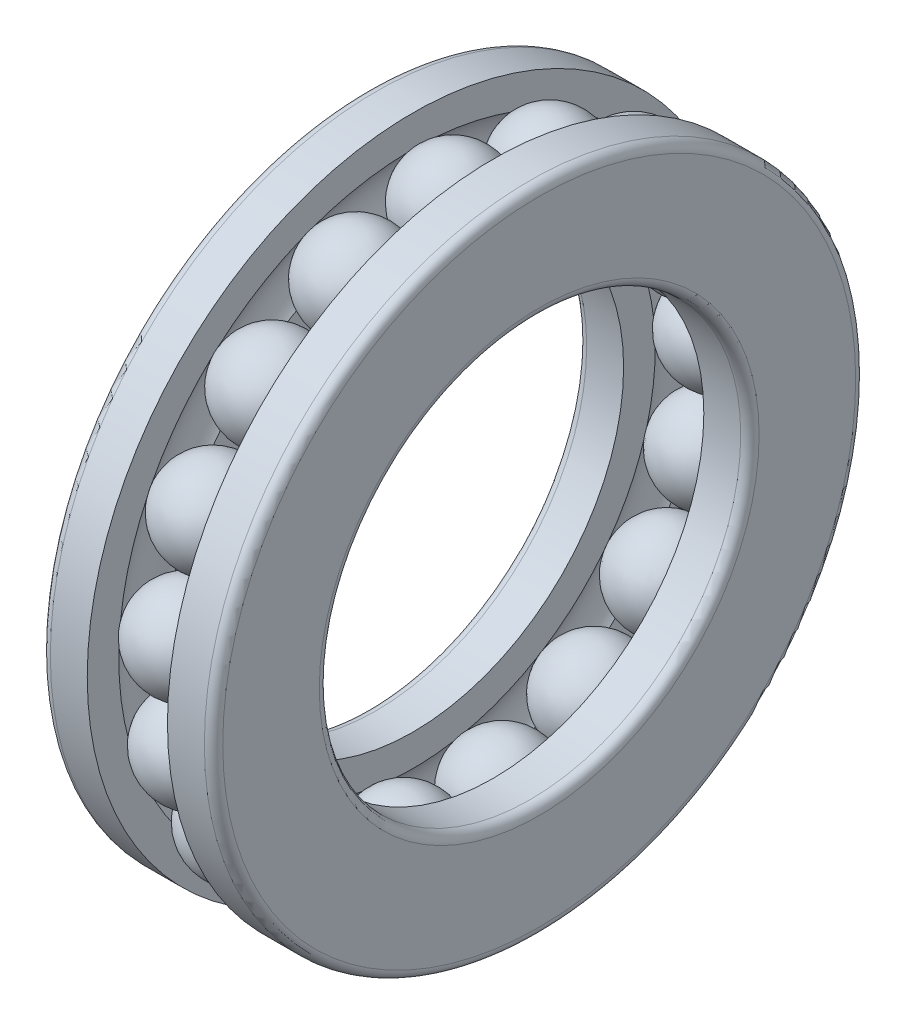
SolidWorks part; units mm, degrees
ref_plane "Plane1" through (0, 0, 0) normal (0, 0, 1) x (1, 0, 0)
ref_plane "Plane2" through (0, 0, 0) normal (0, 1, 0) x (1, 0, 0)
ref_plane "Plane3" through (0, 0, 0) normal (1, 0, 0) x (0, 0, -1)
sketch "Clipboard" plane through (0, 0, 0) normal (0, 0, 1) x (1, 0, 0)
  line L0 (-10, 0) -> (10, 0) construction
  line L1 (0, 0) -> (21.3836, -6.5376)
  line L2 (0, 0) -> (27.3662, 35.0271)
  line L3 (0, 0) -> (13.7666, -17.6205)
  line L4 (0, 0) -> (-22.3471, -0.7804)
  dimension "BallCLRad" = 44.45
  dimension "Count" = 52
  dimension "Show_count" = 52
  dimension "Max_count" = 17
  dimension "Min_count" = 2
sketch "InnRacSke" plane through (0, 0, 0) normal (0, 0, 1) x (1, 0, 0)
  line L0 (-6.6469, 40.1573) -> (-6.6469, 34.925)
  line L1 (-6.6469, 34.925) -> (-12.7635, 34.925)
  line L2 (-14.2875, 36.449) -> (-14.2875, 52.451)
  line L3 (-12.7635, 53.975) -> (-6.6469, 53.975)
  line L4 (-6.6469, 53.975) -> (-6.6469, 48.7427)
  line L5 (-34.925, 0) -> (34.925, 0) construction
  line L6 (0, 0) -> (0, 25.4) construction
  arc A0 (-12.7635, 34.925) -> (-14.2875, 36.449) centre (-12.7635, 36.449) cw
  arc A1 (-14.2875, 52.451) -> (-12.7635, 53.975) centre (-12.7635, 52.451) cw
  arc A2 (-6.6469, 48.7427) -> (-6.6469, 40.1573) centre (0, 44.45) ccw
  dimension "Ball_diameter" = 15.825
  dimension "ID" = 69.85
  dimension "OD" = 107.95
  dimension "Width" = 28.575
  dimension "gap" = 13.2937
  dimension "BallCLRad" = 44.45
revolve "Race" add sketch "InnRacSke" angle 360 about L5
ref_axis "Axis1" through (-50, 0, 0) along (1, 0, 0)
sketch "BalDetSke" plane through (0, 0, 0) normal (0, 0, 1) x (1, 0, 0)
  line L0 (-7.9375, 44.45) -> (7.9375, 44.45)
  line L1 (-14.5732, 44.45) -> (14.5732, 44.45) construction
  arc A0 (7.9375, 44.45) -> (-7.9375, 44.45) centre (0, 44.45) cw
  dimension "Ball_diameter" = 15.875
  dimension "BallCLRad" = 44.45
revolve "BallDetailed" add sketch "BalDetSke" angle 360 about L1
sketch "BalSimSke" plane through (0, 0, 0) normal (0, 0, 1) x (1, 0, 0)
  line L0 (-25.4, 0) -> (25.4, 0) construction
  circle A0 centre (0, 44.45) radius 7.9375
  dimension "Ball_diameter" = 15.875
  dimension "BallCLRad" = 44.45
revolve "BallsSimplified" [suppressed] add sketch "BalSimSke" angle 360 about L0
mirror "Mirror1" about plane through (0, 0, 0) normal (1, 0, 0) of "Race"
pattern_circular "BallsDetailed" count 17 every 21.176 about axis through (-50, 0, 0) along (1, 0, 0) of "BallDetailed"
sketch "CagSpiSke" plane through (0, 0, 0) normal (0, 0, 1) x (1, 0, 0)
  line L0 (1.9844, 35.7188) -> (1.9844, 53.1812)
  line L1 (1.9844, 53.1812) -> (-1.9844, 53.1812)
  line L2 (-1.9844, 53.1812) -> (-1.9844, 35.7188)
  line L3 (-1.9844, 35.7188) -> (1.9844, 35.7188)
  line L4 (-34.925, 0) -> (34.925, 0) construction
  line L5 (0, 0) -> (0, 50.8) construction
  dimension "Thickness" = 3.9688
  dimension "ID" = 71.4375
  dimension "OD" = 106.3625
revolve "CageSpine" [suppressed] add sketch "CagSpiSke" angle 360 about L4
equation "\"BallCLRad@Clipboard\" =  ( \"OD@InnRacSke\" + \"ID@InnRacSke\" )  / 4"
equation "\"BallCLRad@BalSimSke\" = \"BallCLRad@Clipboard\""
equation "\"BallCLRad@BalDetSke\" = \"BallCLRad@Clipboard\""
equation "\"BallCLRad@InnRacSke\" = \"BallCLRad@Clipboard\""
equation "\"Ball_diameter@InnRacSke\" = \"Ball_diameter@BalDetSke\" - 0.05"
equation "\"Ball_diameter@BalSimSke\" = \"Ball_diameter@BalDetSke\""
equation "\"Max_count@Clipboard\" = int( 3.14159265 / atn(( \"Ball_diameter@BalDetSke\" / 2) / sqr( \"BallCLRad@Clipboard\"  *  \"BallCLRad@Clipboard\" - ( \"Ball_diameter@BalDetSke\" / 2) *  ( \"Ball_diameter@BalDetSke\" "
equation "\"Max_count@Clipboard\" = ((sgn( \"Max_count@Clipboard\" - \"Count@Clipboard\" )-1)*( \"Max_count@Clipboard\" - \"Count@Clipboard\" ))/-2+ \"Count@Clipboard\""
equation "\"Count@BallsDetailed\" = int( \"Show_count@Clipboard\" ) "
equation "\"Count@BallsDetailed\" = ((sgn( \"Count@BallsDetailed\" - \"Max_count@Clipboard\" )-1)*( \"Count@BallsDetailed\" - \"Max_count@Clipboard\" ))/-2+ \"Max_count@Clipboard\""
equation "\"Count@BallsDetailed\" = ((sgn( \"Count@BallsDetailed\" - \"Min_count@Clipboard\" )+1)*( \"Count@BallsDetailed\" - \"Min_count@Clipboard\"))/2 +\"Min_count@Clipboard\""
equation "\"Angle@BallsDetailed\" = 360.0 / \"Max_count@Clipboard\""
equation "\"Angle@CageSpine\" =  \"Angle@BallsDetailed\" * ( \"Count@BallsDetailed\" -1 + int( \"Count@BallsDetailed\" / \"Max_count@Clipboard\" ) )  + 0.001 -  int( \"Count@BallsDetailed\" / \"Max_count@Clipboard\" ) * 0.00"
equation "\"Angle@CageSpine\" =  \"Angle@CageSpine\" * int( \"Min_count@Clipboard\" / 2) + int(1 / \"Min_count@Clipboard\")  * 0.001"
equation "\"Thickness@CagSpiSke\" =  \"Ball_diameter@BalDetSke\" * 0.25"
equation "\"OD@CagSpiSke\" = ( \"OD@InnRacSke\" + ( \"BallCLRad@Clipboard\" * 2 + \"Ball_diameter@BalDetSke\" )) / 2"
equation "\"ID@CagSpiSke\" = ( \"ID@InnRacSke\" + ( \"BallCLRad@Clipboard\" * 2 - \"Ball_diameter@BalDetSke\" )) / 2"
